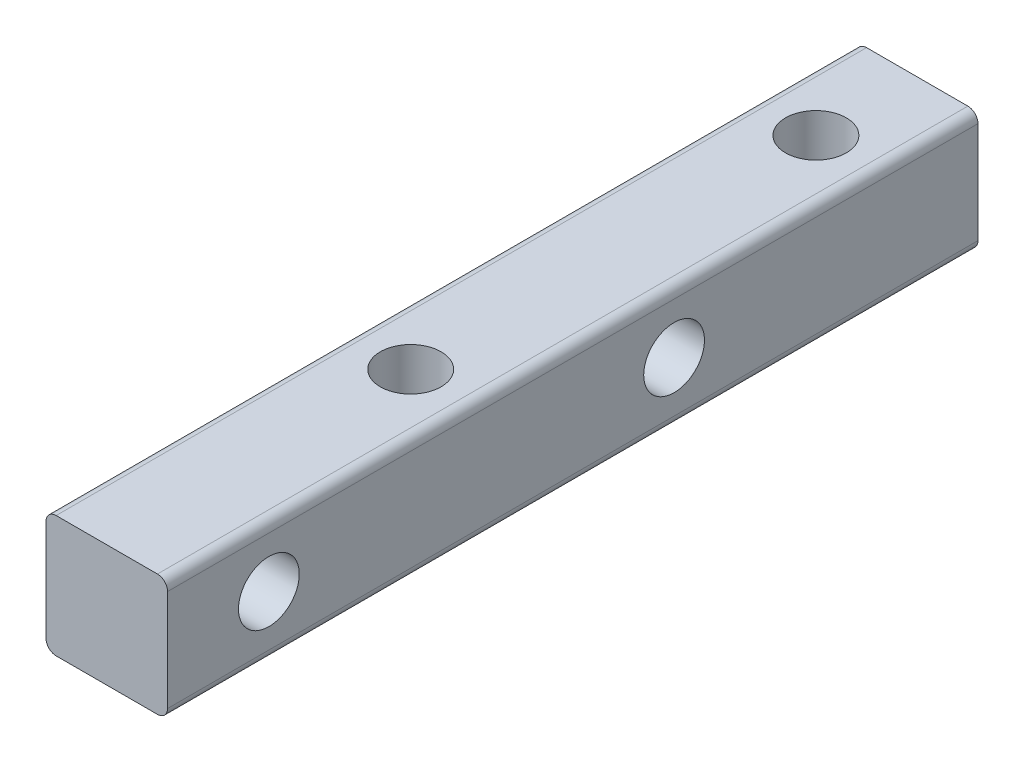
SolidWorks part; units mm, degrees
ref_plane "前视基准面" through (0, 0, 0) normal (0, 0, 1) x (1, 0, 0)
ref_plane "上视基准面" through (0, 0, 0) normal (0, 1, 0) x (1, 0, 0)
ref_plane "右视基准面" through (0, 0, 0) normal (1, 0, 0) x (0, 0, -1)
sketch "草图1" plane through (0, 0, 0) normal (0, 0, 1) x (1, 0, 0)
  line L1 (0, 0) -> (6, 0)
  line L2 (0, 0) -> (0, 6)
  line L3 (0, 6) -> (6, 6)
  line L4 (6, 0) -> (6, 6)
  dimension "D1" = 6
  dimension "D2" = 6
extrude "凸台-拉伸1" add sketch "草图1" along normal blind 40
sketch "草图2" plane through (0, 6, 0) normal (0, 1, 0) x (1, 0, 0)
  line L0 (3, 0) -> (3, -5) construction
  line L1 (6, 0) -> (0, 0) construction
  line L2 (3, -5) -> (3, -25) construction
  circle A0 centre (3, -5) radius 1.5
  circle A1 centre (3, -25) radius 1.5
  dimension "D1" = 3
  dimension "D2" = 5
  dimension "D3" = 20
extrude "切除-拉伸1" cut sketch "草图2" against normal blind 50
sketch "草图3" plane through (0, 0, 0) normal (-1, 0, 0) x (0, 0, 1)
  line L0 (0, 3) -> (15, 3) construction
  line L1 (0, 6) -> (0, 0) construction
  line L2 (15, 3) -> (35, 3) construction
  circle A0 centre (35, 3) radius 1.5
  circle A1 centre (15, 3) radius 1.5
  dimension "D3" = 3
  dimension "D1" = 15
  dimension "D2" = 20
extrude "切除-拉伸2" cut sketch "草图3" against normal blind 50
fillet "圆角1" radius 0.5 4 edges at (6, 6, 20) (6, 0, 20) (0, 0, 20) (0, 6, 20)
